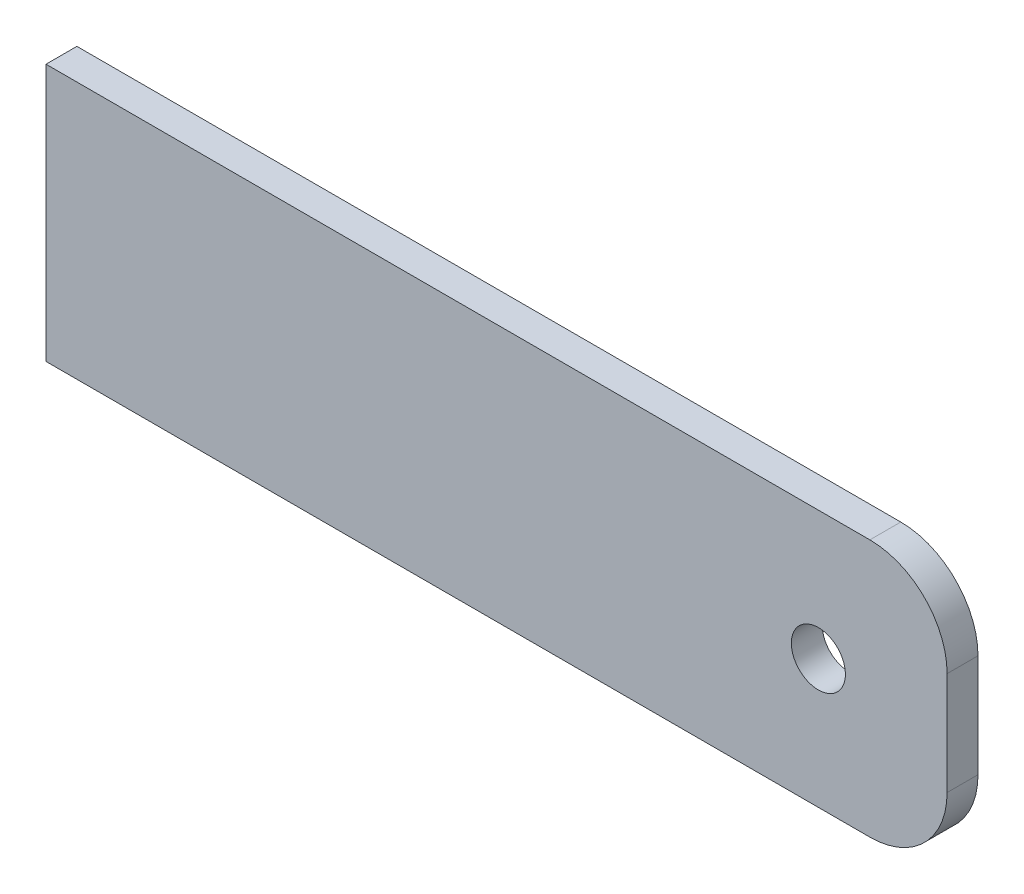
SolidWorks part; units mm, degrees
ref_plane "Face" through (0, 0, 0) normal (0, 0, 1) x (1, 0, 0)
ref_plane "Dessus" through (0, 0, 0) normal (0, 1, 0) x (1, 0, 0)
ref_plane "Droite" through (0, 0, 0) normal (1, 0, 0) x (0, 0, -1)
sketch "Esquisse1" plane through (0, 0, 0) normal (0, 0, 1) x (1, 0, 0)
  line L1 (0, 0) -> (320, 0)
  line L2 (0, 0) -> (0, -100)
  line L3 (0, -100) -> (320, -100)
  line L4 (350, -30) -> (350, -70)
  circle A0 centre (300, -50) radius 10.5
  arc A1 (320, 0) -> (350, -30) centre (320, -30) cw
  arc A2 (320, -100) -> (350, -70) centre (320, -70) ccw
  point P9 (350, 0)
  dimension "D3" = 21
  dimension "D6" = 30
  dimension "D1" = 350
  dimension "D2" = 100
  dimension "D4" = 50
  dimension "D5" = 300
extrude "Base-Extrusion" add sketch "Esquisse1" along normal blind 12
